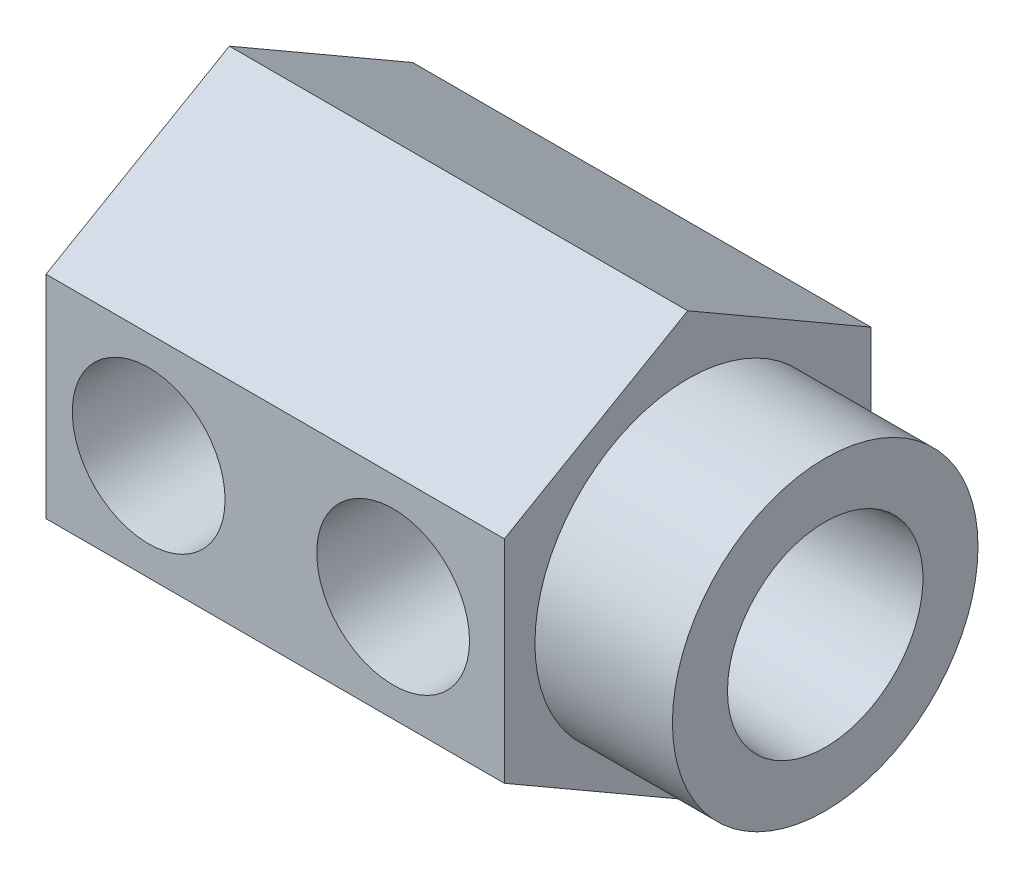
SolidWorks part; units mm, degrees
ref_plane "Front Plane" through (0, 0, 0) normal (0, 0, 1) x (1, 0, 0)
ref_plane "Top Plane" through (0, 0, 0) normal (0, 1, 0) x (1, 0, 0)
ref_plane "Right Plane" through (0, 0, 0) normal (1, 0, 0) x (0, 0, -1)
sketch "Sketch1" plane through (0, 0, 0) normal (1, 0, 0) x (0, 0, -1)
  line L0 (0, 12.0984) -> (0, -12.0984) construction
  line L1 (9.525, -5.4993) -> (9.525, 5.4993)
  line L2 (9.525, 5.4993) -> (0, 10.9985)
  line L3 (0, 10.9985) -> (-9.525, 5.4993)
  line L4 (-9.525, 5.4993) -> (-9.525, -5.4993)
  line L5 (-9.525, -5.4993) -> (0, -10.9985)
  line L6 (0, -10.9985) -> (9.525, -5.4993)
  circle A0 centre (0, 0) radius 9.525 construction
  dimension "D1" = 19.05
extrude "Boss-Extrude1" add sketch "Sketch1" along normal blind 23.8125 separate body
sketch "Sketch2" plane through (23.8125, 0, 0) normal (1, 0, 0) x (0, 0, -1)
  circle A1 centre (0, 0) radius 7.9375
  dimension "D1" = 15.875
extrude "Boss-Extrude2" add sketch "Sketch2" along normal blind 7.1437
sketch "Sketch3" plane through (0, 0, 0) normal (0, 1, 0) x (1, 0, 0)
  line L0 (30.9563, -7.9375) -> (30.9563, 7.9375) construction
  line L1 (30.9563, 0) -> (30.9563, 5.0775)
  line L2 (-5.6164, 0) -> (49994.3836, 0) construction
  line L8 (14.3193, 0) -> (14.3193, 3.4163)
  line L9 (23.9712, 3.4163) -> (14.3193, 3.4163)
  line L10 (23.9712, 3.4163) -> (23.9712, 4.7114)
  line L11 (30.9563, 5.0775) -> (23.9712, 4.7114)
  line L12 (14.3193, 0) -> (30.9563, 0)
  dimension "D1" = 6.8326
  dimension "D2" = 16.637
  dimension "D3" = 6.985
  dimension "D4" = 3
  dimension "D5" = 10.1549
revolve "Cut-Revolve1" cut sketch "Sketch3" angle 360 about L2
hole_wizard "1/16 NPT Tapped Hole1" positions "Sketch5" profile "Sketch4" size "1/16" standard "Ansi Inch"
sketch "Sketch5" plane through (0, 0, -9.525) normal (0, 0, -1) x (-1, 0, 0)
  line L0 (10.4775, 0) -> (-10.4775, 0) construction
  line L1 (0, 10.4775) -> (0, -10.4775) construction
  point P0 (-5.334, 0)
  dimension "D1" = 5.334
sketch "Sketch4" plane through (5.334, 0, -9.525) normal (1, 0, 0) x (0, 1, 0)
  line L0 (0, 0) -> (0, 13.4367)
  line L1 (3.0734, 11.59) -> (0, 13.4367)
  line L2 (-3.0734, 11.59) -> (0, 13.4367) construction
  line L3 (3.0734, 11.59) -> (3.0734, 6.8859)
  line L4 (3.0734, 6.8859) -> (3.7626, 6.8859)
  line L5 (3.7626, 6.8859) -> (3.9688, 0)
  line L6 (-3.7626, 6.8859) -> (-3.9688, 0) construction
  line L7 (3.9688, 0) -> (0, 0)
  line L8 (0, -6.35) -> (0, 107.95) construction
  line L11 (-3.0734, 6.8859) -> (-3.7626, 6.8859) construction
  dimension "Tap Drill Dia." = 6.1468
  dimension "Tap Drill Depth" = 11.59
  dimension "Thread Dia." = 7.9375
  dimension "Thread Angle" = 3.43
  dimension "Thread Depth" = 6.8859
  dimension "Drill Angle" = 118
hole_wizard "1/16 NPT Tapped Hole2" positions "Sketch7" profile "Sketch6" size "1/16" standard "Ansi Inch"
sketch "Sketch7" plane through (0, 0, 9.525) normal (0, 0, 1) x (1, 0, 0)
  circle A0 centre (5.334, 0) radius 3.9688 construction
  point P0 (5.334, 0)
  point P1 (18.034, 0)
  dimension "D1" = 12.7
sketch "Sketch6" plane through (5.334, 0, 9.525) normal (1, 0, 0) x (0, -1, 0)
  line L0 (0, 0) -> (0, 17.7217)
  line L1 (3.0734, 15.875) -> (0, 17.7217)
  line L2 (-3.0734, 15.875) -> (0, 17.7217) construction
  line L3 (3.0734, 15.875) -> (3.0734, 6.8859)
  line L4 (3.0734, 6.8859) -> (3.7626, 6.8859)
  line L5 (3.7626, 6.8859) -> (3.9688, 0)
  line L6 (-3.7626, 6.8859) -> (-3.9688, 0) construction
  line L7 (3.9688, 0) -> (0, 0)
  line L8 (0, -6.35) -> (0, 107.95) construction
  line L11 (-3.0734, 6.8859) -> (-3.7626, 6.8859) construction
  dimension "Tap Drill Dia." = 6.1468
  dimension "Tap Drill Depth" = 15.875
  dimension "Thread Dia." = 7.9375
  dimension "Thread Angle" = 3.43
  dimension "Thread Depth" = 6.8859
  dimension "Drill Angle" = 118
hole_wizard "#21 (0.159) Diameter Hole1" positions "Sketch9" profile "Sketch8" hole size "#21" standard "Ansi Inch"
sketch "Sketch9" plane through (30.9563, 0, 0) normal (1, 0, 0) x (0, 0, -1)
  circle A0 centre (0, 0) radius 5.0775 construction
  point P0 (0, 0)
sketch "Sketch8" plane through (30.9563, 0, 0) normal (0, 1, 0) x (0, 0, -1)
  line L0 (0, 0) -> (0, 26.6133)
  line L1 (0, 26.6133) -> (2.0193, 25.4)
  line L2 (2.0193, 25.4) -> (2.0193, 0)
  line L5 (2.0193, 0) -> (0, 0)
  line L10 (0, 26.6133) -> (-2.0193, 25.4) construction
  line L11 (0, -6.35) -> (0, 107.95) construction
  dimension "Hole Dia." = 4.0386
  dimension "Hole Depth" = 25.4
  dimension "Drill Angle" = 118
hole_wizard "3/16 (0.1875) Diameter Hole1" positions "Sketch11" profile "Sketch10" hole size "3/16" standard "Ansi Inch"
sketch "Sketch11" plane through (30.9563, 0, 0) normal (1, 0, 0) x (0, 0, -1)
  circle A0 centre (0, 0) radius 5.0775 construction
  point P0 (0, 0)
sketch "Sketch10" plane through (30.9563, 0, 0) normal (0, 1, 0) x (0, 0, -1)
  line L0 (0, 0) -> (0, 24.2908)
  line L1 (0, 24.2908) -> (2.3812, 22.86)
  line L2 (2.3812, 22.86) -> (2.3812, 0)
  line L5 (2.3812, 0) -> (0, 0)
  line L10 (0, 24.2908) -> (-2.3813, 22.86) construction
  line L11 (0, -6.35) -> (0, 107.95) construction
  dimension "Hole Dia." = 4.7625
  dimension "Hole Depth" = 22.86
  dimension "Drill Angle" = 118
